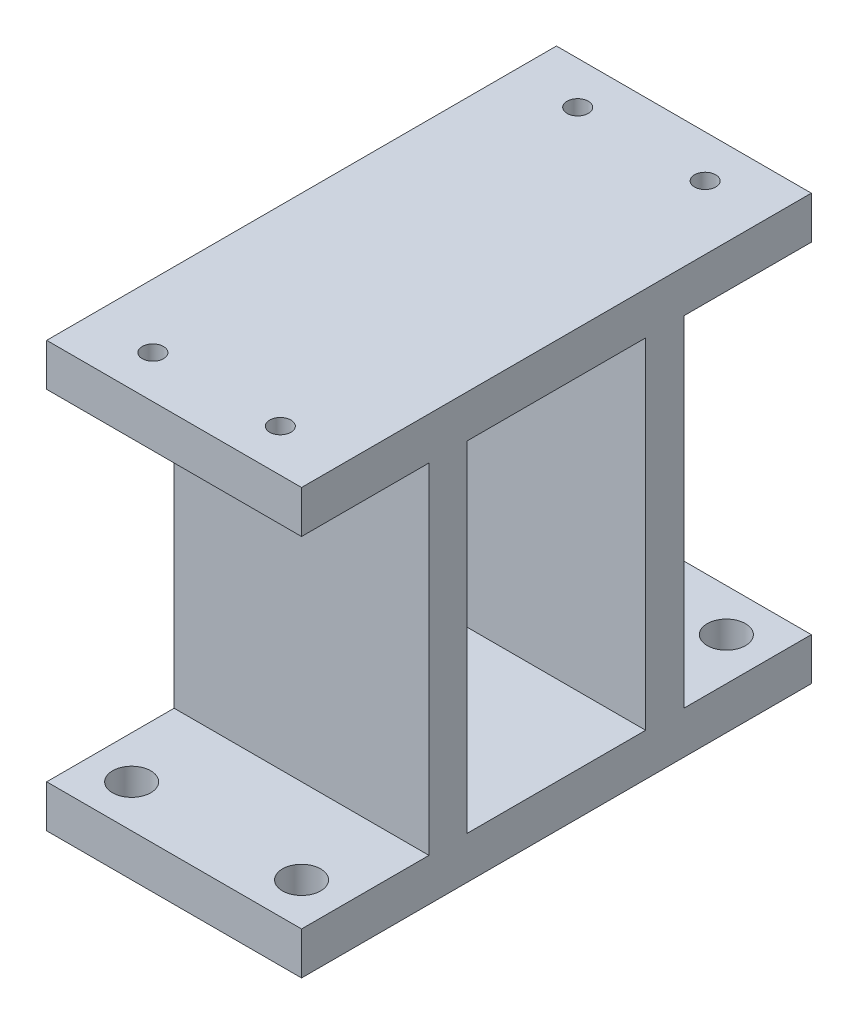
SolidWorks part; units mm, degrees
ref_plane "Front Plane" through (0, 0, 0) normal (0, 0, 1) x (1, 0, 0)
ref_plane "Top Plane" through (0, 0, 0) normal (0, 1, 0) x (1, 0, 0)
ref_plane "Right Plane" through (0, 0, 0) normal (1, 0, 0) x (0, 0, -1)
ref_plane "Plane1" through (0, 0, 0) normal (0, 1, 0) x (1, 0, 0)
sketch "Sketch1" plane through (0, 0, 0) normal (0, 1, 0) x (1, 0, 0)
  line L0 (0, 120) -> (0, 0)
  line L1 (0, 0) -> (60, 0)
  line L2 (60, 0) -> (60, 120)
  line L3 (60, 120) -> (0, 120)
  circle A0 centre (50, 10) radius 4.5
  circle A1 centre (50, 110) radius 4.5
  circle A2 centre (10, 10) radius 4.5
  circle A3 centre (10, 110) radius 4.5
extrude "Boss-Extrude1" add sketch "Sketch1" along normal blind 10
ref_plane "Plane2" through (0, 10, 0) normal (0, 1, 0) x (1, 0, 0)
sketch "Sketch2" plane through (0, 10, 0) normal (0, 1, 0) x (1, 0, 0)
  line L0 (0, 39) -> (0, 30)
  line L1 (0, 30) -> (60, 30)
  line L2 (60, 30) -> (60, 39)
  line L3 (60, 39) -> (0, 39)
extrude "Boss-Extrude2" add sketch "Sketch2" along normal blind 80
ref_plane "Plane3" through (0, 10, 0) normal (0, 1, 0) x (1, 0, 0)
sketch "Sketch3" plane through (0, 10, 0) normal (0, 1, 0) x (1, 0, 0)
  line L0 (0, 81) -> (60, 81)
  line L1 (60, 81) -> (60, 90)
  line L2 (60, 90) -> (0, 90)
  line L3 (0, 90) -> (0, 81)
extrude "Boss-Extrude3" add sketch "Sketch3" along normal blind 80
ref_plane "Plane4" through (0, 90, 0) normal (0, 1, 0) x (1, 0, 0)
sketch "Sketch4" plane through (0, 90, 0) normal (0, 1, 0) x (1, 0, 0)
  line L0 (0, 120) -> (0, 0)
  line L1 (0, 0) -> (60, 0)
  line L2 (60, 0) -> (60, 120)
  line L3 (60, 120) -> (0, 120)
extrude "Boss-Extrude4" add sketch "Sketch4" along normal blind 10
hole_wizard "M5x0.8 Tapped Hole1" positions "Sketch5" profile "Sketch6" tap size "M5x0.8" standard "ANSI Metric"
sketch "Sketch5" plane through (0, 100, 0) normal (0, 1, 0) x (1, 0, 0)
  line L0 (45, 110) -> (15, 110) construction
  line L1 (15, 110) -> (15, 10) construction
  line L2 (15, 10) -> (45, 10) construction
  line L3 (45, 10) -> (45, 110) construction
  line L5 (60, 0) -> (60, 120) construction
  line L6 (0, 0) -> (60, 0) construction
  point P0 (15, 10)
  point P2 (45, 10)
  point P4 (45, 110)
  point P6 (15, 110)
  point P19 (45, 60)
  point P22 (60, 60)
  point P23 (30, 10)
  point P26 (30, 0)
  dimension "D1" = 100
  dimension "D2" = 30
sketch "Sketch6" plane through (15, 100, -10) normal (1, 0, 0) x (0, 0, 1)
  line L0 (0, 0) -> (0, 10)
  line L1 (0, 10) -> (2.5, 10)
  line L2 (2.5, 10) -> (2.5, 0)
  line L5 (2.5, 0) -> (0, 0)
  line L11 (0, -6.35) -> (0, 107.95) construction
  dimension "Thread Major Dia." = 5
  dimension "Thru Tap Drill Depth" = 10
